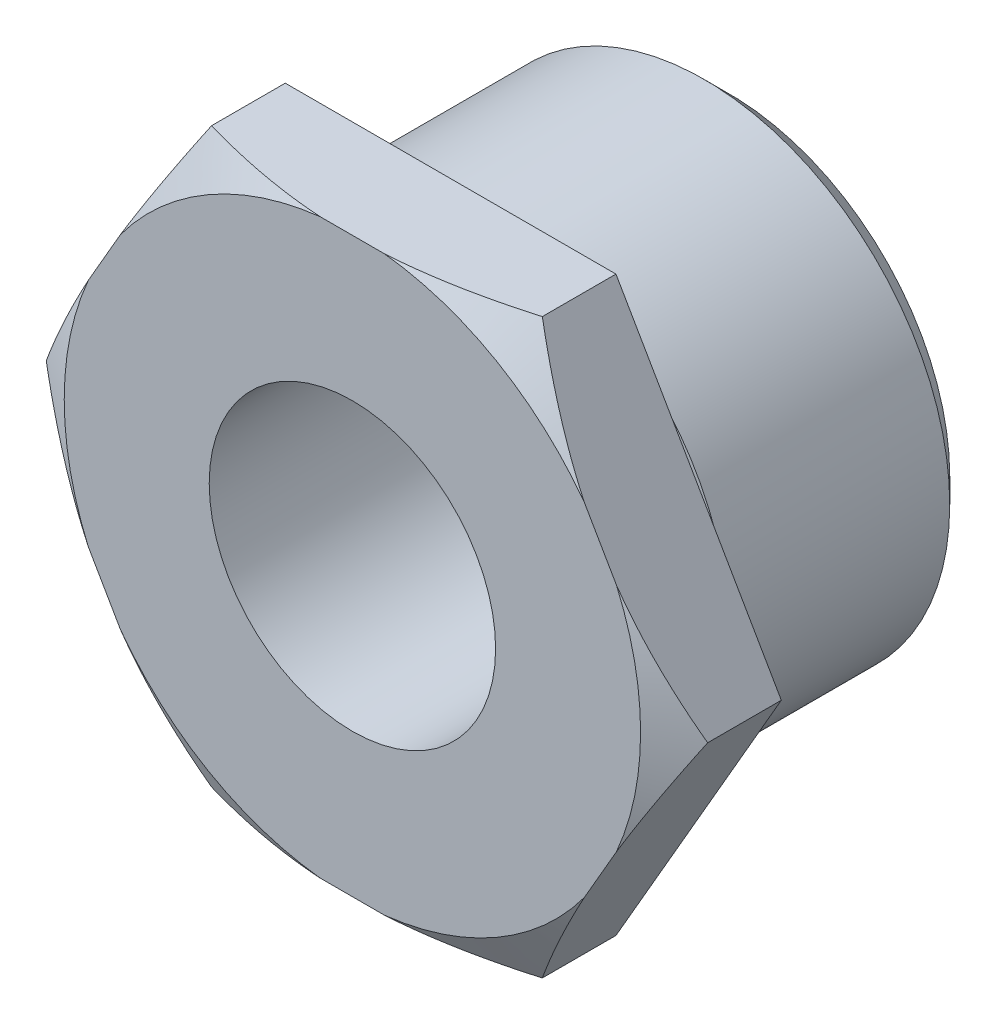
SolidWorks part; units mm, degrees
ref_plane "Plan1" through (0, 0, 0) normal (0, 0, 1) x (1, 0, 0)
ref_plane "Plan2" through (0, 0, 0) normal (0, 1, 0) x (1, 0, 0)
ref_plane "Plan3" through (0, 0, 0) normal (1, 0, 0) x (0, 0, -1)
sketch "Esquisse1" plane through (0, 0, 0) normal (0, 0, 1) x (1, 0, 0)
  line L1 (-20.2073, 0) -> (-10.1036, -17.5)
  line L2 (-10.1036, -17.5) -> (10.1036, -17.5)
  line L3 (10.1036, -17.5) -> (20.2073, 0)
  line L4 (20.2073, 0) -> (10.1036, 17.5)
  line L5 (10.1036, 17.5) -> (-10.1036, 17.5)
  line L6 (-10.1036, 17.5) -> (-20.2073, 0)
  circle A0 centre (0, 0) radius 17.5 construction
  dimension "D1" = 35
extrude "Base-Extrusion" add sketch "Esquisse1" along normal blind 6
sketch "Esquisse2" plane through (0, 0, 0) normal (0, 1, 0) x (1, 0, 0)
  line L0 (-20.2073, -4.5) -> (-17.6092, -6)
  line L1 (-20.2073, -4.5) -> (-20.2073, -6)
  line L3 (-20.2073, -6) -> (-17.6092, -6)
  line L5 (0, 0) -> (0, -7.3) construction
  dimension "D1" = 1.5
  dimension "D2" = 60
revolve "Enlèvement de matière-Révolution1" cut sketch "Esquisse2" angle 360 about L5
sketch "Esquisse3" plane through (0, 0, 0) normal (1, 0, 0) x (0, 0, -1)
  line L0 (0, 13.5) -> (2, 13.5)
  line L1 (0, 0) -> (0, 17.5) construction
  line L2 (2, 13.5) -> (2, 15)
  line L3 (2, 15) -> (15.5, 15)
  line L4 (15.5, 15) -> (17, 13.5)
  line L5 (17, 13.5) -> (17, 0)
  line L6 (0, 0) -> (10, 0) construction
  line L7 (0, 0) -> (0, 13.5)
  line L8 (0, 0) -> (17, 0)
  dimension "D1" = 45
  dimension "D2" = 1.5
  dimension "D3" = 1.5
  dimension "D4" = 2
  dimension "D5" = 17
  dimension "D6" = 30
revolve "Boss.-Révol.1" add sketch "Esquisse3" angle 360 about L6
sketch "Esquisse4" plane through (0, 0, 6) normal (0, 0, 1) x (1, 0, 0)
  circle A0 centre (0, 0) radius 8.75
  dimension "D1" = 17.5
extrude "Enlèv. mat.-Extru.1" cut sketch "Esquisse4" against normal through all
